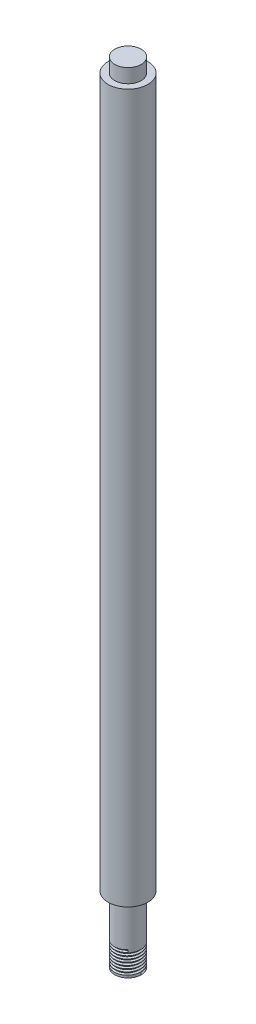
SolidWorks part; units mm, degrees
ref_plane "Front Plane" through (0, 0, 0) normal (0, 0, 1) x (1, 0, 0)
ref_plane "Top Plane" through (0, 0, 0) normal (0, 1, 0) x (1, 0, 0)
ref_plane "Right Plane" through (0, 0, 0) normal (1, 0, 0) x (0, 0, -1)
sketch "Sketch1" plane through (0, 0, 0) normal (0, 1, 0) x (1, 0, 0)
  circle A0 centre (0, 0) radius 2.25
  dimension "D1" = 4.5
extrude "Boss-Extrude1" add sketch "Sketch1" along normal blind 80.275
sketch "Sketch2" plane through (0, 0, 0) normal (0, -1, 0) x (1, 0, 0)
  circle A0 centre (0, 0) radius 1.5
  dimension "D1" = 3
extrude "Boss-Extrude2" add sketch "Sketch2" along normal blind 7.5
thread "Thread1" pitch 0.3175 start angle 0, offset 0, length 2.5, pitch 0.3175, diameter 3
ref_plane "Plane1" through (1.5, -7.5, 0) normal (0, 0, 1) x (1, 0, 0)
sketch "Thread Profile1" plane through (1.5, -7.5, 0) normal (0, 0, 1) x (1, 0, 0)
  line L0 (0, 0) -> (0, 0.3175) construction
  line L11 (0, 0) -> (0, 0.2778)
  line L12 (0, 0.2778) -> (-0.1719, 0.1786)
  line L13 (-0.1719, 0.1786) -> (-0.1719, 0.0992)
  line L15 (-0.1719, 0.0992) -> (0, 0)
  line L17 (-0.1719, 0.1389) -> (0, 0.1389) construction
  point P2 (0, 0)
  dimension "Pitch" = 0.3175
  dimension "Profile_Angle" = 60
  dimension "Profile_Land" = 0.0794
  dimension "Profile_Height" = 0.1719
sketch "Sketch5" plane through (0, 80.275, 0) normal (0, 1, 0) x (1, 0, 0)
  circle A0 centre (0, 0) radius 1.5
  dimension "D1" = 3
extrude "Boss-Extrude3" add sketch "Sketch5" along normal blind 1.5875
